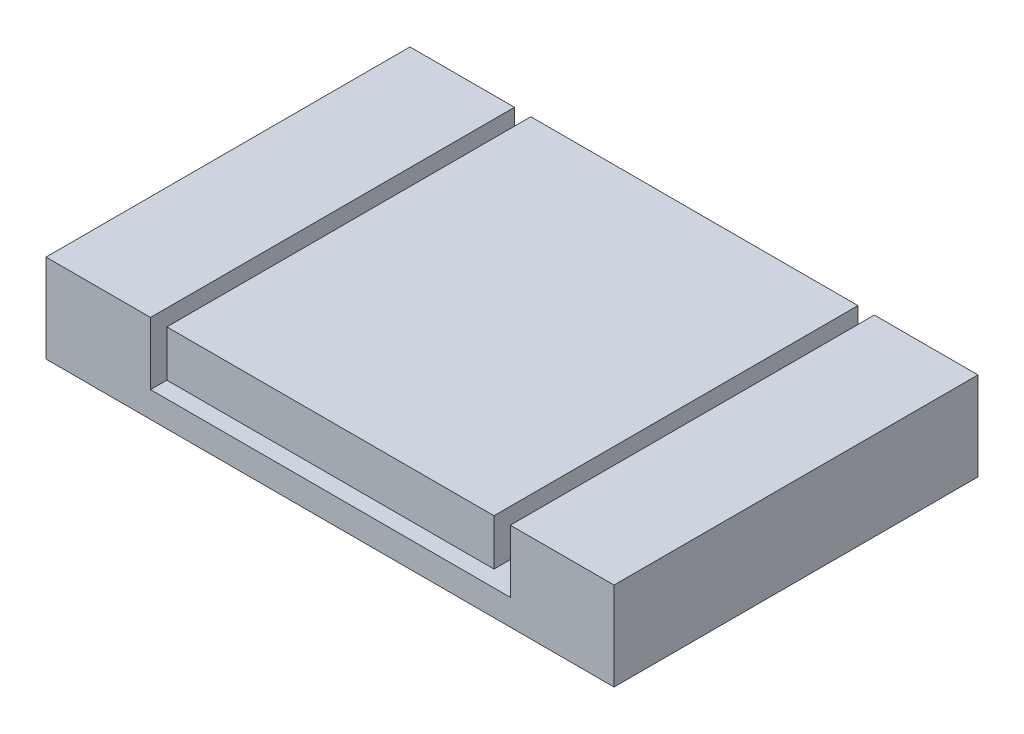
SolidWorks part; units mm, degrees
ref_plane "Front Plane" through (0, 0, 0) normal (0, 0, 1) x (1, 0, 0)
ref_plane "Top Plane" through (0, 0, 0) normal (0, 1, 0) x (1, 0, 0)
ref_plane "Right Plane" through (0, 0, 0) normal (1, 0, 0) x (0, 0, -1)
sketch "Sketch1" plane through (0, 0, 0) normal (0, 1, 0) x (1, 0, 0)
  line L0 (86.7956, -55.6147) -> (-86.7956, 55.6147) construction
  line L1 (-86.7956, 55.6147) -> (86.7956, 55.6147)
  line L2 (-86.7956, 55.6147) -> (-86.7956, -55.6147)
  line L3 (-86.7956, -55.6147) -> (86.7956, -55.6147)
  line L4 (86.7956, 55.6147) -> (86.7956, -55.6147)
extrude "Extrude1" add sketch "Sketch1" along normal blind 27
sketch "Sketch2" plane through (0, 0, 55.6147) normal (0, 0, 1) x (1, 0, 0)
  line L1 (-49.8523, 39.5807) -> (50.1093, 39.5807)
  line L2 (-49.8523, 39.5807) -> (-49.8523, 12.8935)
  line L3 (-49.8523, 12.8935) -> (50.1093, 12.8935)
  line L4 (50.1093, 39.5807) -> (50.1093, 12.8935)
  point P4 (0, 0)
  point P5 (0, 0)
extrude "Cut-Extrude-Thin1" cut sketch "Sketch2" against normal through all thin
